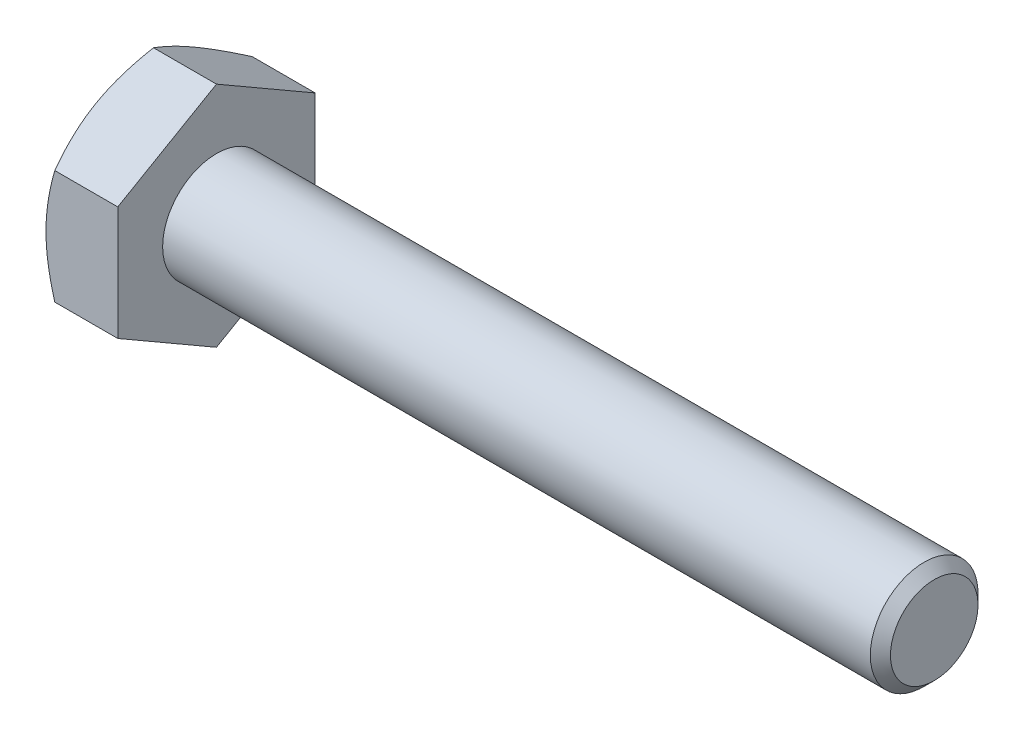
SolidWorks part; units mm, degrees
extrude "BaseHead" add sketch "Sketch1" along normal blind 2
sketch "Sketch1" plane through (0, 0, 0) normal (1, 0, 0) x (0, 0, -1)
  line L0 (2.75, 1.5877) -> (2.75, -1.5877)
  line L1 (-2.75, 1.5877) -> (-2.75, -1.5877)
  line L2 (2.75, -1.5877) -> (0, -3.1754)
  line L3 (0, -3.1754) -> (-2.75, -1.5877)
  line L4 (2.75, 1.5877) -> (0, 3.1754)
  line L5 (0, 3.1754) -> (-2.75, 1.5877)
ref_plane "Plane1" through (0, 0, 0) normal (0, 0, 1) x (1, 0, 0)
ref_plane "Plane2" through (0, 0, 0) normal (0, 1, 0) x (1, 0, 0)
ref_plane "Plane3" through (0, 0, 0) normal (1, 0, 0) x (0, 0, -1)
other "Configuration Table"
sketch "BodySke" plane through (0, 0, 0) normal (0, 0, 1) x (1, 0, 0)
  line L1 (0, 0) -> (22, 0)
  line L2 (0, 0) -> (0, 1.5)
  line L4 (22, 0) -> (22, 1.2195)
  line L5 (2, 3.1754) -> (2, 1.5877) construction
  line L6 (22, 1.2195) -> (21.7195, 1.5)
  line L7 (0, 0) -> (110.49, 0) construction
  line L8 (22, -1.2195) -> (21.7195, -1.5) construction
  line L9 (0, 1.5877) -> (0, -1.5877) construction
  line L10 (2.5, 15.24) -> (2.5, -1.27) construction
  line L11 (10, 15.24) -> (10, -1.27) construction
  line L12 (2, 1.5877) -> (2, -1.5877) construction
  line L15 (0, 1.5) -> (21.7195, 1.5)
revolve "BaseBody" add sketch "BodySke" angle 360 about L7
fillet "HeadFillet" [suppressed] radius 0.1
sketch "Sketch3" plane through (0, 0, 0) normal (0, 0, 1) x (1, 0, 0)
  line L0 (0, 2.75) -> (3.1324, 8.1754)
  line L1 (0, 3.1754) -> (0, 1.5877) construction
  line L2 (3.1324, 8.1754) -> (3.1324, 13.1754)
  line L3 (3.1324, 13.1754) -> (-10, 13.1754)
  line L4 (-10, 13.1754) -> (-10, 2.75)
  line L5 (-10, 2.75) -> (0, 2.75)
  line L6 (0, 0) -> (99.06, 0) construction
  line L7 (2, 3.1754) -> (0, 3.1754) construction
revolve "HeadChamfer" cut sketch "Sketch3" angle 360 about L6
sketch "ThdSchSke" plane through (0, 0, 0) normal (0, 0, 1) x (1, 0, 0)
  line L0 (10, -1.2195) -> (9.8036, -1.5)
  line L1 (10, -1.2195) -> (10.1964, -1.5)
  line L2 (10.1964, -1.5) -> (10.1964, -1.875)
  line L3 (-3.175, 0) -> (5.1513, 0) construction
  line L5 (10.1964, -1.875) -> (9.8036, -1.875)
  line L6 (9.8036, -1.875) -> (9.8036, -1.5)
revolve "ThreadSchematic" [suppressed] cut sketch "ThdSchSke" angle 360 about L3
pattern_linear "ThdSchPat" [suppressed]
equation "\"D3@Sketch1\" = \"Width_flats@Sketch1\" / 2"
equation "\"D4@Sketch1\" = \"D3@Sketch1\""
equation "\"D5@Sketch1\" = \"D4@Sketch1\""
equation "\"Thread_minor@ThreadCosmetic\" = \"Minor_dia@BodySke\""
equation "\"D1@Sketch3\" = \"Width_flats@Sketch1\" / 2"
equation "\"Thread_length@ThreadCosmetic\" = ((sgn( (\"Length@BodySke\" - \"Advance@BodySke\" ) - \"Thread_nom@BodySke\" )-1)*( (\"Length@BodySke\" - \"Advance@BodySke\" ) - \"Thread_nom@BodySke\" ))/-2+ \"Thread_nom@BodySke\""
equation "\"Thread_minor@ThdSchSke\" = \"Minor_dia@BodySke\""
equation "\"Diameter@ThdSchSke\" = \"Diameter@BodySke\""
equation "\"Overcut@ThdSchSke\" = \"Diameter@BodySke\" * 1.25"
equation "\"Start@ThdSchSke\" = \"Head_ht@BaseHead\" + \"Length@BodySke\" - \"Thread_length@ThreadCosmetic\"  '---Non-countersunk---"
equation "\"Num_threads@ThdSchPat\" = int( \"Thread_length@ThreadCosmetic\" / \"Advance@BodySke\" + 0.999 )  + 1"
equation "\"Advance@ThdSchPat\" = \"Thread_length@ThreadCosmetic\" /  (\"Num_threads@ThdSchPat\" - 1) 'relax it"
equation "\"Num_threads@ThdSchPat\" = \"Num_threads@ThdSchPat\" - sgn( \"Num_threads@ThdSchPat\" - 1) '---chamfered tips only---"
